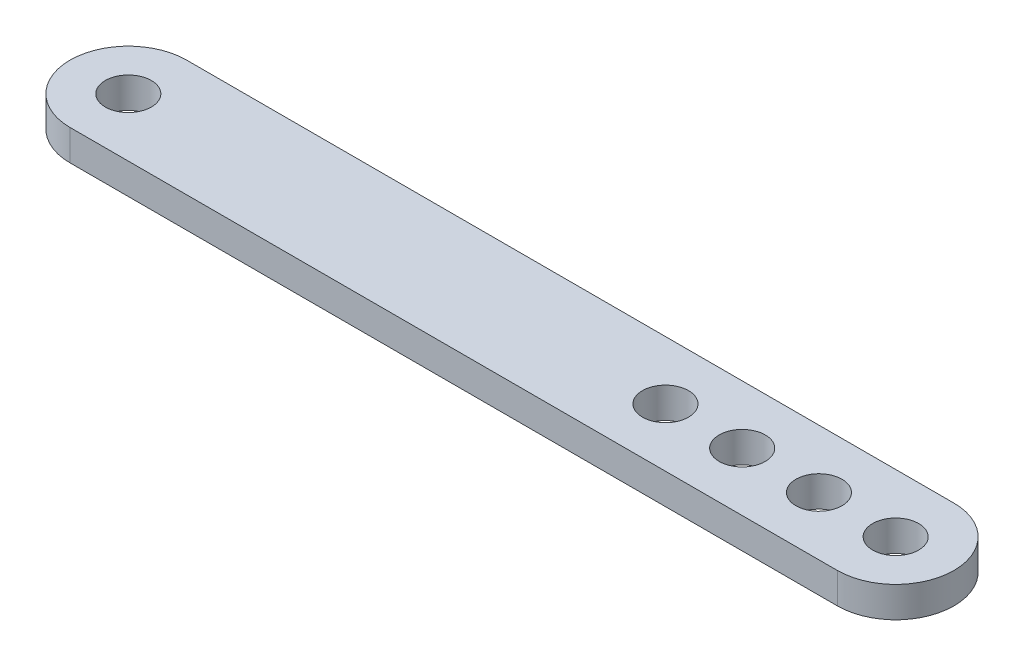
SolidWorks part; units mm, degrees
ref_plane "Front Plane" through (0, 0, 0) normal (0, 0, 1) x (1, 0, 0)
ref_plane "Top Plane" through (0, 0, 0) normal (0, 1, 0) x (1, 0, 0)
ref_plane "Right Plane" through (0, 0, 0) normal (1, 0, 0) x (0, 0, -1)
sketch "Sketch1" plane through (0, 0, 0) normal (0, 1, 0) x (1, 0, 0)
  line L1 (25, -3.8) -> (-25, -3.8)
  line L2 (25, -3.8) -> (25, 3.8)
  line L3 (25, 3.8) -> (-25, 3.8)
  line L4 (-25, -3.8) -> (-25, 3.8)
  line L5 (25, -3.8) -> (-25, 3.8) construction
  line L6 (25, 3.8) -> (-25, -3.8) construction
  circle A0 centre (-25, 0) radius 3.8
  circle A1 centre (25, 0) radius 3.8
  circle A2 centre (-25, 0) radius 1.5
  circle A3 centre (25, 0) radius 1.5
  circle A4 centre (20, 0) radius 1.5
  circle A5 centre (15, 0) radius 1.5
  circle A6 centre (10, 0) radius 1.5
  point P0 (0, 0)
  dimension "D3" = 3
  dimension "D4" = 3
  dimension "D1" = 50
  dimension "D2" = 7.6
  dimension "D5" = 4
extrude "Boss-Extrude2" add sketch "Sketch1" along normal blind 2 contours A1 L3 A0 L1 | A2 L4 A0 | A2 L4 A0 | A3 L2 A1 | A3 L2 A1
